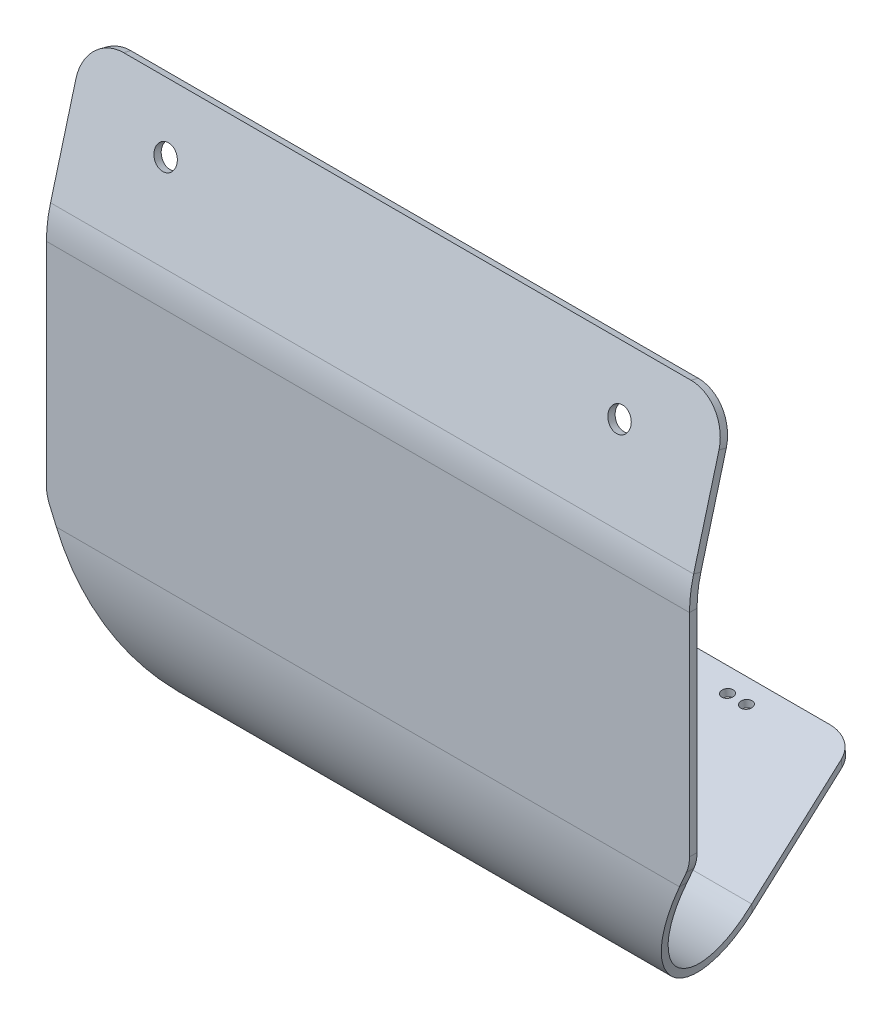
SolidWorks part; units mm, degrees
ref_plane "Face" through (0, 0, 0) normal (0, 0, 1) x (1, 0, 0)
ref_plane "Dessus" through (0, 0, 0) normal (0, 1, 0) x (1, 0, 0)
ref_plane "Droite" through (0, 0, 0) normal (1, 0, 0) x (0, 0, -1)
sketch "Esquisse1" plane through (0, 0, 0) normal (0, 0, 1) x (1, 0, 0)
  line L0 (-75, 57.7268) -> (75, 57.7268)
  line L1 (85, 47.7268) -> (85, -42.2732)
  line L2 (84.1698, -46.2624) -> (27.6149, -176.2624)
  line L3 (18.4451, -182.2732) -> (-18.4451, -182.2732)
  line L4 (-27.6149, -176.2624) -> (-84.1698, -46.2624)
  line L5 (-85, -42.2732) -> (-85, 47.7268)
  circle A0 centre (-60, 42.7268) radius 3
  circle A1 centre (60, 42.7268) radius 3
  arc A2 (85, 47.7268) -> (75, 57.7268) centre (75, 47.7268) ccw
  arc A3 (-85, 47.7268) -> (-75, 57.7268) centre (-75, 47.7268) cw
  arc A4 (-84.1698, -46.2624) -> (-85, -42.2732) centre (-75, -42.2732) cw
  arc A5 (-18.4451, -182.2732) -> (-27.6149, -176.2624) centre (-18.4451, -172.2732) cw
  arc A6 (27.6149, -176.2624) -> (18.4451, -182.2732) centre (18.4451, -172.2732) cw
  arc A7 (85, -42.2732) -> (84.1698, -46.2624) centre (75, -42.2732) cw
  circle A8 centre (2.5, -176.2732) radius 1.5
  circle A9 centre (-2.5, -176.2732) radius 1.5
  point P13 (85, 57.7268)
  point P16 (-85, 57.7268)
  point P19 (-85, -44.3542)
  point P24 (25, -182.2732)
  point P27 (85, -44.3542)
  dimension "D6" = 6
  dimension "D7" = 120
  dimension "D8" = 60
  dimension "D9" = 10
  dimension "D11" = 3
  dimension "D13" = 5
  dimension "D1" = 170
  dimension "D2" = 85
  dimension "D3" = 240
  dimension "D4" = 60
  dimension "D5" = 100
  dimension "D10" = 15
  dimension "D12" = 6
  dimension "D14" = 2.5
extrude "Extrusion1" add sketch "Esquisse1" along normal blind 2
sheet metal parameters "Tôlerie 1" parameters "D1"=10
flatten bends "Dépliage 1" parameters "D1"=0
sketch "Esquisse-Angle1" plane through (0, 0, 2) normal (0, 0, 1) x (1, 0, 0)
process bends "Pliage 1" parameters "D1"=0
sketch "Esquisse-Plate1" plane through (0, 0, 2) normal (0, 0, 1) x (1, 0, 0)
  line L0 (-85, -92.2732) -> (85, -92.2732)
  line L1 (-85, 47.7268) -> (-85, -42.2732) construction
  line L2 (85, -42.2732) -> (85, 47.7268) construction
  line L3 (75, 57.7268) -> (-75, 57.7268) construction
  line L4 (-85, 17.7268) -> (85, 17.7268)
  point P8 (0, -66.6118)
  dimension "D1" = 150
  dimension "D2" = 40
bend "Pli défini à plat1" bend radius 50 bend angle 94 parameters "D5"=1
bend "Pli défini à plat2" bend radius 30 bend angle 15 parameters "D5"=2
